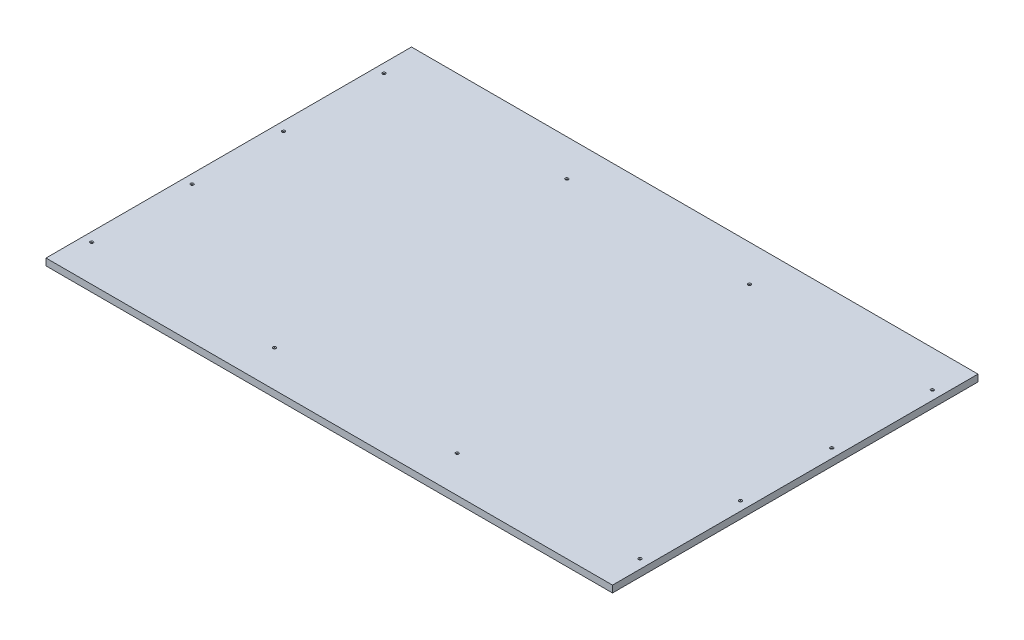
SolidWorks part; units mm, degrees
ref_plane "Front Plane" through (0, 0, 0) normal (0, 0, 1) x (1, 0, 0)
ref_plane "Top Plane" through (0, 0, 0) normal (0, 1, 0) x (1, 0, 0)
ref_plane "Right Plane" through (0, 0, 0) normal (1, 0, 0) x (0, 0, -1)
sketch "Sketch1" plane through (0, 0, 0) normal (0, 1, 0) x (1, 0, 0)
  line L1 (-1219.2, 609.6) -> (1219.2, 609.6)
  line L2 (-1219.2, 609.6) -> (-1219.2, -609.6)
  line L3 (-1219.2, -609.6) -> (1219.2, -609.6)
  line L4 (1219.2, 609.6) -> (1219.2, -609.6)
  line L5 (-1219.2, 609.6) -> (1219.2, -609.6) construction
  line L6 (-1219.2, -609.6) -> (1219.2, 609.6) construction
  point P0 (0, 0)
  dimension "D1" = 2438.4
  dimension "D2" = 1219.2
extrude "Boss-Extrude1" add sketch "Sketch1" along normal blind 19.05
sketch "Sketch2" plane through (0, 19.05, 0) normal (0, 1, 0) x (1, 0, 0)
  line L0 (-1219.2, -609.6) -> (1219.2, -609.6) construction
  line L1 (1219.2, 609.6) -> (355.6, 609.6)
  line L2 (1219.2, 609.6) -> (1219.2, -609.6)
  line L3 (1219.2, -609.6) -> (355.6, -609.6)
  line L4 (355.6, 609.6) -> (355.6, -609.6)
  dimension "D1" = 863.6
extrude "Cut-Extrude1" cut sketch "Sketch2" against normal through all
sketch "Sketch3" plane through (0, 19.05, 0) normal (0, 1, 0) x (1, 0, 0)
  line L0 (355.6, 609.6) -> (355.6, -609.6) construction
  line L1 (-1219.2, -609.6) -> (355.6, -609.6)
  line L2 (-1219.2, -609.6) -> (-1219.2, -406.4)
  line L3 (-1219.2, -406.4) -> (355.6, -406.4)
  line L4 (355.6, -609.6) -> (355.6, -406.4)
  dimension "D1" = 203.2
extrude "Cut-Extrude2" cut sketch "Sketch3" against normal through all
hole_wizard "CSK for #8 Flat Head Machine Screw (100)1" positions "3DSketch1" profile "Sketch4" countersink size "#8" standard "ANSI Inch"
sketch3d "3DSketch1"
  line L0 (-1219.2, 18.2563, -590.55) -> (304.8, 18.2563, -590.55) construction
  line L1 (-1219.2, 18.2562, -609.6) -> (-1219.2, 18.2562, 609.6) construction
  line L2 (304.8, 18.2562, -609.6) -> (304.8, 18.2562, 609.6) construction
  line L4 (304.8, 18.2562, -609.6) -> (-1219.2, 18.2562, -609.6) construction
  point P2 (-952.5, 18.2562, -590.55)
  point P4 (-609.6, 18.2562, -590.55)
  point P6 (-304.8, 18.2562, -590.55)
  point P8 (38.1, 18.2562, -590.55)
  dimension "D1" = 19.05
  dimension "D2" = 266.7
  dimension "D3" = 609.6
  dimension "D4" = 609.6
  dimension "D5" = 266.7
sketch "Sketch4" plane through (-952.5, 18.2562, -590.55) normal (1, 0, 0) x (0, 0, 1)
  line L0 (0, 0) -> (0, 18.2562)
  line L1 (0, 18.2562) -> (2.2479, 18.2562)
  line L2 (2.2479, 18.2562) -> (2.2479, 1.6518)
  line L3 (2.2479, 1.6518) -> (4.2164, 0)
  line L5 (4.2164, 0) -> (0, 0)
  line L6 (-2.2479, 1.6518) -> (-4.2164, 0) construction
  line L11 (0, -6.35) -> (0, 107.95) construction
  dimension "Thru Hole Dia." = 4.4958
  dimension "Thru Hole Depth" = 18.2562
  dimension "Near C'Sink Dia." = 8.4328
  dimension "Near C'Sink Angle" = 100
hole_wizard "CSK for #8 Flat Head Machine Screw (100)2" positions "Sketch6" profile "Sketch5" countersink size "#8" standard "ANSI Inch"
sketch "Sketch6" plane through (0, 18.2562, 0) normal (0, 1, 0) x (1, 0, 0)
  line L0 (-1219.2, -590.55) -> (304.8, -590.55) construction
  line L1 (-1219.2, 609.6) -> (-1219.2, -609.6) construction
  line L2 (304.8, 609.6) -> (304.8, -609.6) construction
  line L4 (-1219.2, -609.6) -> (304.8, -609.6) construction
  line L5 (-1200.15, 609.6) -> (-1200.15, -609.6) construction
  line L6 (304.8, 609.6) -> (-1219.2, 609.6) construction
  line L8 (285.75, 609.6) -> (285.75, -609.6) construction
  line L10 (-1219.2, 438.15) -> (304.8, 438.15) construction
  line L12 (-1219.2, 219.075) -> (304.8, 219.075) construction
  line L14 (-1219.2, 0) -> (304.8, 0) construction
  line L16 (-1219.2, -241.3) -> (304.8, -241.3) construction
  line L18 (-1219.2, -479.425) -> (304.8, -479.425) construction
  point P0 (-1066.8, -590.55)
  point P2 (-812.8, -590.55)
  point P4 (-101.6, -590.55)
  point P6 (152.4, -590.55)
  point P8 (-1200.15, 438.15)
  point P10 (-1200.15, 219.075)
  point P12 (-1200.15, 0)
  point P14 (-1200.15, -241.3)
  point P16 (-1200.15, -479.425)
  point P18 (285.75, -479.425)
  point P20 (285.75, -241.3)
  point P22 (285.75, 0)
  point P24 (285.75, 219.075)
  point P26 (285.75, 438.15)
  dimension "D1" = 19.05
  dimension "D2" = 19.05
  dimension "D3" = 19.05
  dimension "D4" = 171.45
  dimension "D5" = 390.525
  dimension "D6" = 609.6
  dimension "D7" = 850.9
  dimension "D8" = 130.175
  dimension "D9" = 152.4
  dimension "D10" = 406.4
  dimension "D11" = 406.4
  dimension "D12" = 152.4
sketch "Sketch5" plane through (-1066.8, 18.2562, 590.55) normal (1, 0, 0) x (0, 0, 1)
  line L0 (0, 0) -> (0, 18.2562)
  line L1 (0, 18.2562) -> (2.2479, 18.2562)
  line L2 (2.2479, 18.2562) -> (2.2479, 1.6518)
  line L3 (2.2479, 1.6518) -> (4.2164, 0)
  line L5 (4.2164, 0) -> (0, 0)
  line L6 (-2.2479, 1.6518) -> (-4.2164, 0) construction
  line L11 (0, -6.35) -> (0, 107.95) construction
  dimension "Thru Hole Dia." = 4.4958
  dimension "Thru Hole Depth" = 18.2562
  dimension "Near C'Sink Dia." = 8.4328
  dimension "Near C'Sink Angle" = 100
hole_wizard "CSK for #8 Flat Head Machine Screw (100)3" positions "Sketch8" profile "Sketch7" countersink size "#8" standard "ANSI Inch"
sketch "Sketch8"
  line L0 (-1193.8, 609.6) -> (-1193.8, -400.05) construction
  line L1 (355.6, 609.6) -> (-1219.2, 609.6) construction
  line L2 (355.6, -406.4) -> (-1219.2, -406.4) construction
  line L4 (-1219.2, 508) -> (355.6, 508) construction
  line L5 (-1219.2, 609.6) -> (-1219.2, -406.4) construction
  line L6 (355.6, 609.6) -> (355.6, -406.4) construction
  line L8 (330.2, 609.6) -> (330.2, -406.4) construction
  line L10 (-1219.2, -304.8) -> (355.6, -304.8) construction
  line L14 (-1219.2, 228.6) -> (355.6, 228.6) construction
  line L16 (-1219.2, -25.4) -> (355.6, -25.4) construction
  point P2 (-1193.8, 228.6)
  point P4 (-1193.8, -25.4)
  point P10 (330.2, -25.4)
  point P12 (330.2, 228.6)
  point P16 (-1193.8, 508)
  point P18 (-685.8, 508)
  point P20 (-177.8, 508)
  point P22 (330.2, 508)
  point P24 (-1193.8, -304.8)
  point P26 (-685.8, -304.8)
  point P28 (-177.8, -304.8)
  point P30 (330.2, -304.8)
  dimension "D1" = 25.4
  dimension "D2" = 101.6
  dimension "D3" = 25.4
  dimension "D4" = 101.6
  dimension "D6" = 381
  dimension "D7" = 381
  dimension "D9" = 25.4
  dimension "D10" = 533.4
  dimension "D11" = 533.4
  dimension "D12" = 25.4
  dimension "D13" = 25.4
  dimension "D14" = 533.4
  dimension "D15" = 533.4
  dimension "D16" = 25.4
sketch "Sketch7" plane through (-1193.8, 19.05, -228.6) normal (1, 0, 0) x (0, 0, 1)
  line L0 (0, 0) -> (0, 19.05)
  line L1 (0, 19.05) -> (2.2479, 19.05)
  line L2 (2.2479, 19.05) -> (2.2479, 1.6518)
  line L3 (2.2479, 1.6518) -> (4.2164, 0)
  line L5 (4.2164, 0) -> (0, 0)
  line L6 (-2.2479, 1.6518) -> (-4.2164, 0) construction
  line L11 (0, -6.35) -> (0, 107.95) construction
  dimension "Thru Hole Dia." = 4.4958
  dimension "Thru Hole Depth" = 19.05
  dimension "Near C'Sink Dia." = 8.4328
  dimension "Near C'Sink Angle" = 100
